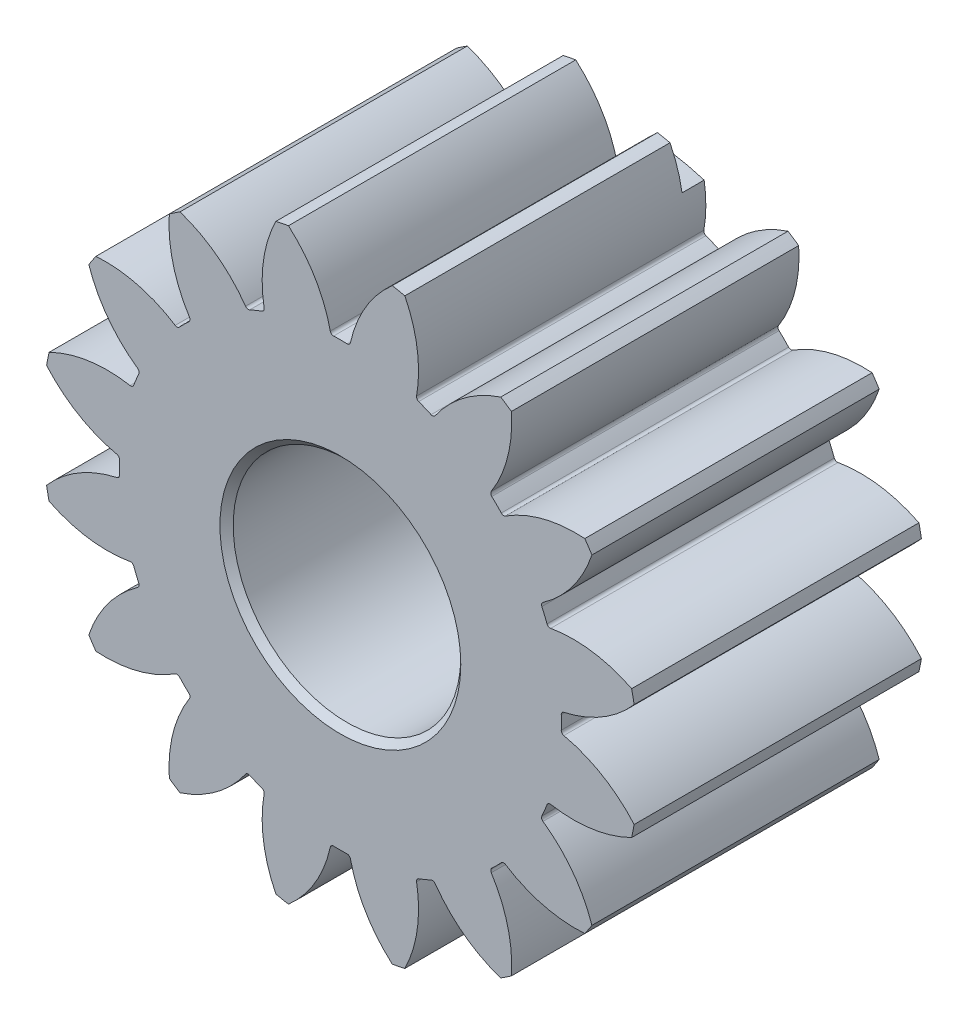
SolidWorks part; units mm, degrees
ref_plane "Plan1" through (0, 0, 0) normal (0, 0, 1) x (1, 0, 0)
ref_plane "Plan2" through (0, 0, 0) normal (0, 1, 0) x (1, 0, 0)
ref_plane "Plan3" through (0, 0, 0) normal (1, 0, 0) x (0, 0, -1)
sketch "Esquisse1" plane through (0, 0, 0) normal (0, 0, 1) x (1, 0, 0)
  circle A0 centre (0, 0) radius 13.5
  dimension "D1" = 27
extrude "Ebauche extérieure" add sketch "Esquisse1" along normal blind 13
sketch "Esquisse2" plane through (0, 0, 13) normal (0, 0, 1) x (1, 0, 0)
  circle A0 centre (0, 0) radius 5.15
  circle A1 centre (0, 0) radius 13.5 construction
  dimension "D1" = 10.3
extrude "alésage 10.3" cut sketch "Esquisse2" against normal through all
chamfer "Chanfrein1" distance 0.3 angle 45
sketch "Esquisse3" plane through (0, 0, 0) normal (0, 0, -1) x (-1, 0, 0)
  line L0 (0, 0) -> (0, 14.5163) construction
  arc A0 (-2.3486, 13.2941) -> (-0.4554, 10.1128) centre (-6.2251, 8.8334) cw
  arc A1 (0.4554, 10.1128) -> (0.3044, 9.9954) centre (0.309, 10.1453) cw
  arc A2 (-0.3044, 9.9954) -> (-0.4554, 10.1128) centre (-0.309, 10.1453) cw
  arc A3 (0.3044, 9.9954) -> (-0.3044, 9.9954) centre (0, 0) ccw
  arc A4 (2.3486, 13.2941) -> (-2.3486, 13.2941) centre (0, 0) ccw
  arc A5 (2.3486, 13.2941) -> (0.4554, 10.1128) centre (6.2251, 8.8334) ccw
  circle A6 centre (0, 0) radius 13.5 construction
  point P7 (0.4297, 9.9908)
  point P11 (-0.4297, 9.9908)
  dimension "D1" = 10
  dimension "D4" = 10.8065
  dimension "D6" = 0.15
extrude "denture" cut sketch "Esquisse3" against normal through all
pattern_circular "Répétition circulaire1" count 16 every 22.5
sketch "Esquisse4" plane through (0, 0, 0) normal (0, 0, -1) x (-1, 0, 0)
  line L0 (-4.538, 11.1088) -> (-6.2538, 15.3088)
  line L1 (0, 12) -> (0, 16.302)
  line L2 (0, 16.302) -> (-6.2538, 15.3088)
  arc A0 (0, 12) -> (-4.538, 11.1088) centre (0, 0) ccw
  dimension "D1" = 24
extrude "Enlèv. mat.-Extru.1" cut sketch "Esquisse4" against normal blind 1
